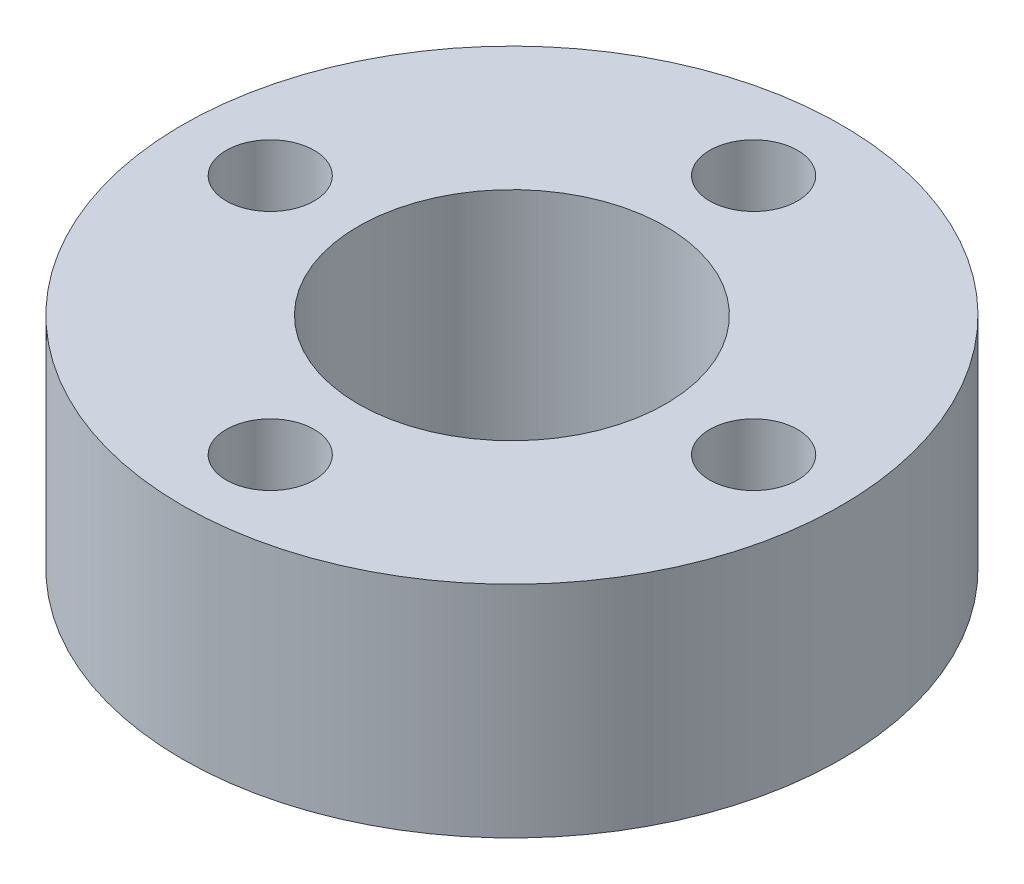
SolidWorks part; units mm, degrees
ref_plane "Front Plane" through (0, 0, 0) normal (0, 0, 1) x (1, 0, 0)
ref_plane "Top Plane" through (0, 0, 0) normal (0, 1, 0) x (1, 0, 0)
ref_plane "Right Plane" through (0, 0, 0) normal (1, 0, 0) x (0, 0, -1)
sketch "Sketch1" plane through (0, 0, 0) normal (0, 1, 0) x (1, 0, 0)
  line L0 (-15, 0) -> (15, 0) construction
  line L1 (0, 15) -> (0, -15) construction
  circle A0 centre (0, 0) radius 15
  circle A1 centre (0, 0) radius 7
  circle A2 centre (0, 0) radius 11 construction
  circle A3 centre (-11, 0) radius 2
  circle A4 centre (0, -11) radius 2
  circle A5 centre (0, 11) radius 2
  circle A6 centre (11, 0) radius 2
  dimension "D1" = 30
  dimension "D2" = 14
  dimension "D3" = 22
  dimension "D4" = 4
  dimension "D5" = 4
  dimension "D6" = 4
  dimension "D7" = 4
extrude "Extrude1" add sketch "Sketch1" along normal blind 10
